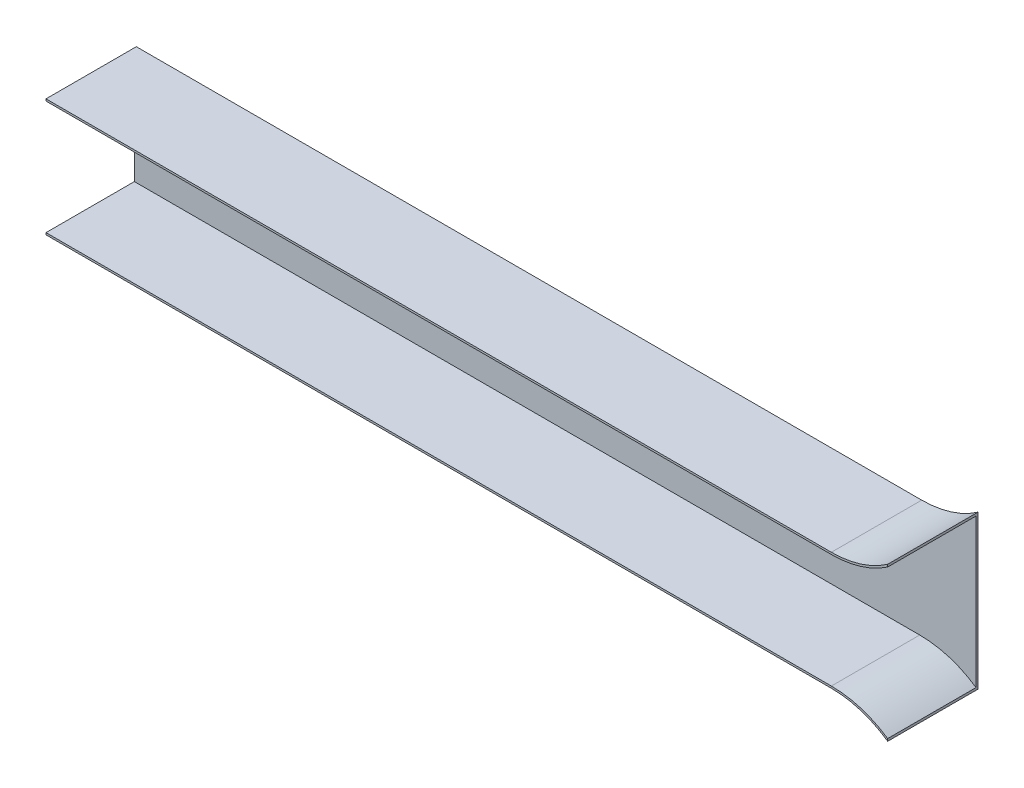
SolidWorks part; units mm, degrees
ref_plane "Face" through (0, 0, 0) normal (0, 0, 1) x (1, 0, 0)
ref_plane "Dessus" through (0, 0, 0) normal (0, 1, 0) x (1, 0, 0)
ref_plane "Droite" through (0, 0, 0) normal (1, 0, 0) x (0, 0, -1)
sketch "Esquisse3" plane through (0, 0, 0) normal (0, 0, 1) x (1, 0, 0)
  line L0 (400, -30) -> (0, -30)
  line L1 (0, 0) -> (453.5196, 0) construction
  line L2 (400, 30) -> (0, 30)
  line L3 (0, 30) -> (0, -30)
  line L4 (400, 30) -> (400, 80) construction
  line L5 (400, 80) -> (428.6788, 39.0424) construction
  line L6 (428.6788, 39.0424) -> (428.6788, -39.0424)
  arc A0 (400, 30) -> (428.6788, 39.0424) centre (400, 80) ccw
  arc A1 (400, -30) -> (428.6788, -39.0424) centre (400, -80) cw
  point P12 (428.6788, 0)
  dimension "D1" = 100
  dimension "D2" = 35
  dimension "D3" = 400
  dimension "D4" = 30
extrude "Base-Extrusion" add sketch "Esquisse3" along normal blind 1
sketch "Esquisse4" plane through (0, 0, 1) normal (0, 0, 1) x (1, 0, 0)
  line L0 (400, 30) -> (0, 30) construction
  line L1 (400, 30) -> (0, 30)
  line L2 (0, 30) -> (0, -30) construction
  line L3 (0, 30) -> (0, 29)
  line L4 (428.6788, -39.0424) -> (428.6788, 39.0424) construction
  line L5 (428.6788, 37.8274) -> (428.6788, 39.0424)
  line L6 (0, 0) -> (451.2107, 0) construction
  line L7 (400, 29) -> (0, 29)
  line L8 (400, -29) -> (0, -29)
  line L9 (428.6788, -37.8274) -> (428.6788, -39.0424)
  line L10 (0, -30) -> (0, -29)
  line L11 (400, -30) -> (0, -30)
  arc A0 (400, 30) -> (428.6788, 39.0424) centre (400, 80) ccw construction
  arc A1 (400, 30) -> (428.6788, 39.0424) centre (400, 80) ccw
  arc A2 (400, 29) -> (428.6788, 37.8274) centre (400, 80) ccw
  arc A3 (400, -29) -> (428.6788, -37.8274) centre (400, -80) cw
  arc A4 (400, -30) -> (428.6788, -39.0424) centre (400, -80) cw
  dimension "D1" = 1
extrude "Boss.-Extru.1" add sketch "Esquisse4" along normal blind 45
